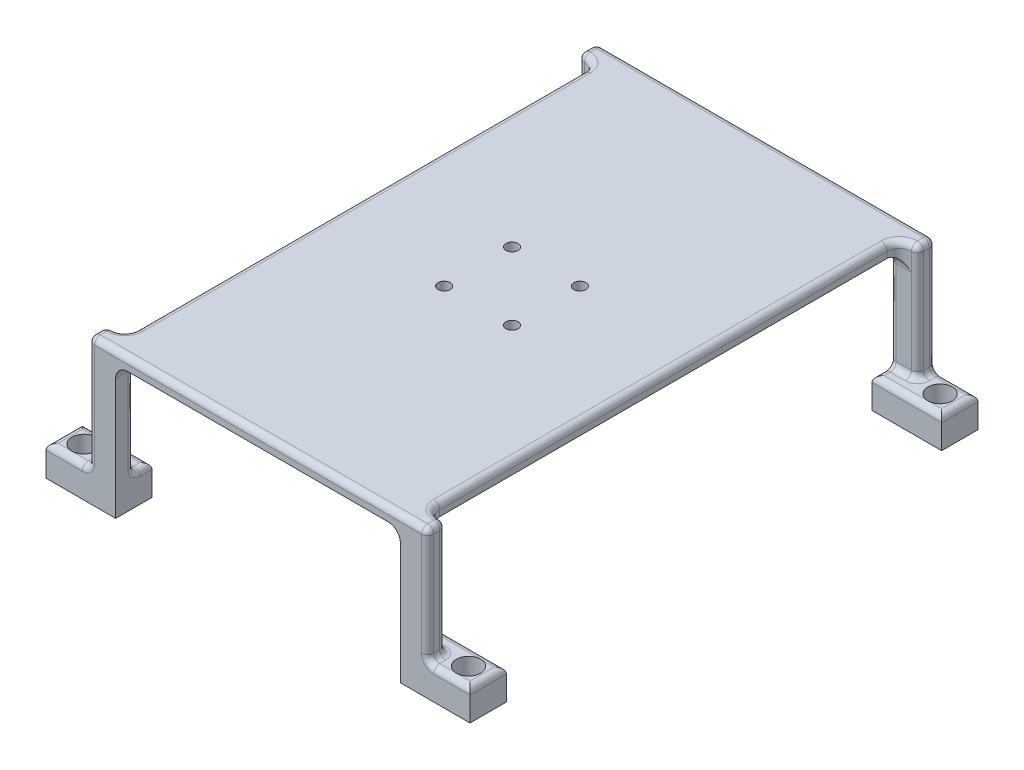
SolidWorks part; units mm, degrees
ref_plane "Front Plane" through (0, 0, 0) normal (0, 0, 1) x (1, 0, 0)
ref_plane "Top Plane" through (0, 0, 0) normal (0, 1, 0) x (1, 0, 0)
ref_plane "Right Plane" through (0, 0, 0) normal (1, 0, 0) x (0, 0, -1)
sketch "Sketch1" plane through (0, 0, 0) normal (0, 1, 0) x (1, 0, 0)
  line L1 (25, -41.93) -> (-25, -41.93)
  line L2 (25, -41.93) -> (25, 41.93)
  line L3 (25, 41.93) -> (-25, 41.93)
  line L4 (-25, -41.93) -> (-25, 41.93)
  line L5 (25, -41.93) -> (-25, 41.93) construction
  line L6 (25, 41.93) -> (-25, -41.93) construction
  line L7 (-25, 41.93) -> (-28, 41.93)
  line L8 (-25, 41.93) -> (-25, 38.93)
  line L9 (-25, 38.93) -> (-28, 38.93)
  line L10 (-28, 41.93) -> (-28, 38.93)
  line L11 (-25, -41.93) -> (-28, -41.93)
  line L12 (-25, -41.93) -> (-25, -38.93)
  line L13 (-25, -38.93) -> (-28, -38.93)
  line L14 (-28, -41.93) -> (-28, -38.93)
  line L15 (25, -41.93) -> (28, -41.93)
  line L16 (25, -41.93) -> (25, -38.93)
  line L17 (25, -38.93) -> (28, -38.93)
  line L18 (28, -41.93) -> (28, -38.93)
  line L19 (25, 41.93) -> (28, 41.93)
  line L20 (25, 41.93) -> (25, 38.93)
  line L21 (25, 38.93) -> (28, 38.93)
  line L22 (28, 41.93) -> (28, 38.93)
  point P0 (0, 0)
  dimension "D1" = 50
  dimension "D2" = 83.86
  dimension "D3" = 3
extrude "Boss-Extrude1" add sketch "Sketch1" along normal blind 2 contours L7 L10 L9 L4 | L4 L1 L2 L3 | L15 L18 L17 L2 | L14 L11 L4 L13 | L19 L22 L21 L20
sketch "Sketch2" plane through (0, 0, 0) normal (0, -1, 0) x (1, 0, 0)
  line L1 (-28, 41.93) -> (-23.5, 41.93)
  line L2 (-28, 41.93) -> (-28, 38.93)
  line L3 (-28, 38.93) -> (-23.5, 38.93)
  line L4 (-23.5, 41.93) -> (-23.5, 38.93)
  line L5 (-28, -41.93) -> (-23.5, -41.93)
  line L6 (-28, -41.93) -> (-28, -38.93)
  line L7 (-28, -38.93) -> (-23.5, -38.93)
  line L8 (-23.5, -41.93) -> (-23.5, -38.93)
  line L9 (28, -41.93) -> (23.5, -41.93)
  line L10 (28, -41.93) -> (28, -38.93)
  line L11 (28, -38.93) -> (23.5, -38.93)
  line L12 (23.5, -41.93) -> (23.5, -38.93)
  line L13 (28, 41.93) -> (23.5, 41.93)
  line L14 (28, 41.93) -> (28, 38.93)
  line L15 (28, 38.93) -> (23.5, 38.93)
  line L16 (23.5, 41.93) -> (23.5, 38.93)
  dimension "D1" = 3
  dimension "D2" = 4.5
extrude "Boss-Extrude2" add sketch "Sketch2" along normal blind 22
fillet "Fillet1" radius 2 12 edges at (-23.5, 0, 40.43) (-25, 1, 38.93) (-24.25, 0, 38.93) (-25, 1, -38.93) (-24.25, 0, -38.93) (-23.5, 0, -40.43) (25, 1, -38.93) (24.25, 0, -38.93) (23.5, 0, -40.43) (24.25, 0, 38.93) (23.5, 0, 40.43) (25, 1, 38.93)
fillet "Fillet2" radius 1 16 edges at (27.5, 2, 38.93) (25.5858, 2, 38.3442) (27.5, 2, -38.93) (25.5858, 2, -38.3442) (-27.5, 2, 38.93) (-25.5858, 2, 38.3442) (-27.5, 2, -38.93) (-25.5858, 2, -38.3442) (28, 2, -40.43) (25, 2, 0) (28, 2, 40.43) (0, 2, 41.93) (-28, 2, 40.43) (-25, 2, 0) (0, 2, -41.93) (-28, 2, -40.43)
sketch "Sketch3" plane through (0, -22, 0) normal (0, -1, 0) x (1, 0, 0)
  line L0 (-23.5, -38.93) -> (-28, -38.93)
  line L1 (-28, -38.93) -> (-28, -41.93)
  line L2 (-28, -41.93) -> (-35, -41.93)
  line L3 (-35, -41.93) -> (-35, -35.93)
  line L4 (-35, -35.93) -> (-23.5, -35.93)
  line L5 (-23.5, -35.93) -> (-23.5, -38.93)
  line L6 (0, 0) -> (0, -41.93) construction
  line L7 (21.5, -41.93) -> (-21.5, -41.93) construction
  line L8 (0, 0) -> (-25, 0) construction
  line L9 (-25, 36.93) -> (-25, -36.93) construction
  line L10 (-23.5, 35.93) -> (-23.5, 38.93)
  line L11 (-35, 35.93) -> (-23.5, 35.93)
  line L12 (-35, 41.93) -> (-35, 35.93)
  line L13 (-28, 41.93) -> (-35, 41.93)
  line L14 (-28, 38.93) -> (-28, 41.93)
  line L15 (-23.5, 38.93) -> (-28, 38.93)
  line L16 (23.5, -35.93) -> (23.5, -38.93)
  line L17 (35, -35.93) -> (23.5, -35.93)
  line L18 (35, -41.93) -> (35, -35.93)
  line L19 (28, -41.93) -> (35, -41.93)
  line L20 (28, -38.93) -> (28, -41.93)
  line L21 (23.5, -38.93) -> (28, -38.93)
  line L22 (23.5, 38.93) -> (28, 38.93)
  line L23 (28, 38.93) -> (28, 41.93)
  line L24 (28, 41.93) -> (35, 41.93)
  line L25 (35, 41.93) -> (35, 35.93)
  line L26 (35, 35.93) -> (23.5, 35.93)
  line L27 (23.5, 35.93) -> (23.5, 38.93)
  dimension "D1" = 6
  dimension "D2" = 7
extrude "Boss-Extrude3" add sketch "Sketch3" against normal blind 5
sketch "Sketch4" plane through (0, -17, 0) normal (0, 1, 0) x (1, 0, 0)
  line L0 (-35, 38.93) -> (-31.75, 38.93) construction
  line L1 (-35, 35.93) -> (-35, 41.93) construction
  line L2 (-31.75, 38.93) -> (-31.75, 35.93) construction
  line L3 (-23.5, 35.93) -> (-35, 35.93) construction
  line L4 (-28, 41.93) -> (-28, 38.93) construction
  line L5 (0, 0) -> (0, 40.93) construction
  line L6 (27, 40.93) -> (-27, 40.93) construction
  line L7 (0, 0) -> (-24, 0) construction
  line L8 (-24, 36.93) -> (-24, -36.93) construction
  circle A0 centre (-31.75, 38.93) radius 2
  circle A1 centre (31.75, 38.93) radius 2
  circle A2 centre (31.75, -38.93) radius 2
  circle A3 centre (-31.75, -38.93) radius 2
  dimension "D1" = 4
  dimension "D2" = 3.75
extrude "Cut-Extrude1" cut sketch "Sketch4" against normal through all
fillet "Fillet3" radius 1 48 edges at (22.9142, -0.5858, -38.3442) (22.9142, -0.5858, 38.3442) (-22.9142, -0.5858, 38.3442) (27.7071, 1.7071, -41.6371) (23.5, -9.5, -38.93) (27.7071, 1.7071, 41.6371) (23.5, -9.5, 38.93) (-23.5, -9.5, 38.93) (-27.7071, 1.7071, 41.6371) (-27.7071, 1.7071, -41.6371) (-22.9142, -0.5858, -38.3442) (28, -8, -41.93) (25.75, -17, -38.93) (28, -8, 41.93) (25.75, -17, 38.93) (-25.75, -17, 38.93) (-28, -8, 41.93) (-28, -8, -41.93) (-23.5, -9.5, -38.93) (27.7071, 1.7071, -39.2229) (27.7071, 1.7071, 39.2229) (-27.7071, 1.7071, 39.2229) (-27.7071, 1.7071, -39.2229) (31.5, -17, -41.93) (35, -17, -38.93) (29.25, -17, -35.93) (23.5, -17, -37.43) (28, -8, -38.93) (28, -17, -40.43) (31.5, -17, 41.93) (35, -17, 38.93) (28, -8, 38.93) (28, -17, 40.43) (29.25, -17, 35.93) (23.5, -17, 37.43) (-23.5, -17, 37.43) (-35, -17, 38.93) (-28, -8, 38.93) (-28, -17, 40.43) (-29.25, -17, 35.93) (-31.5, -17, 41.93) (-28, -8, -38.93) (-35, -17, -38.93) (-31.5, -17, -41.93) (-23.5, -17, -37.43) (-29.25, -17, -35.93) (-25.75, -17, -38.93) (-28, -17, -40.43)
sketch "Sketch5" plane through (0, 2, 0) normal (0, 1, 0) x (1, 0, 0)
  line L1 (5.6, -5.6) -> (-5.6, -5.6) construction
  line L2 (5.6, -5.6) -> (5.6, 5.6) construction
  line L3 (5.6, 5.6) -> (-5.6, 5.6) construction
  line L4 (-5.6, -5.6) -> (-5.6, 5.6) construction
  line L5 (5.6, -5.6) -> (-5.6, 5.6) construction
  line L6 (5.6, 5.6) -> (-5.6, -5.6) construction
  circle A0 centre (-5.6, 5.6) radius 1
  circle A1 centre (5.6, 5.6) radius 1
  circle A2 centre (5.6, -5.6) radius 1
  circle A3 centre (-5.6, -5.6) radius 1
  point P0 (0, 0)
  dimension "D3" = 2
  dimension "D1" = 11.2
  dimension "D2" = 11.2
extrude "Cut-Extrude2" cut sketch "Sketch5" against normal through all
